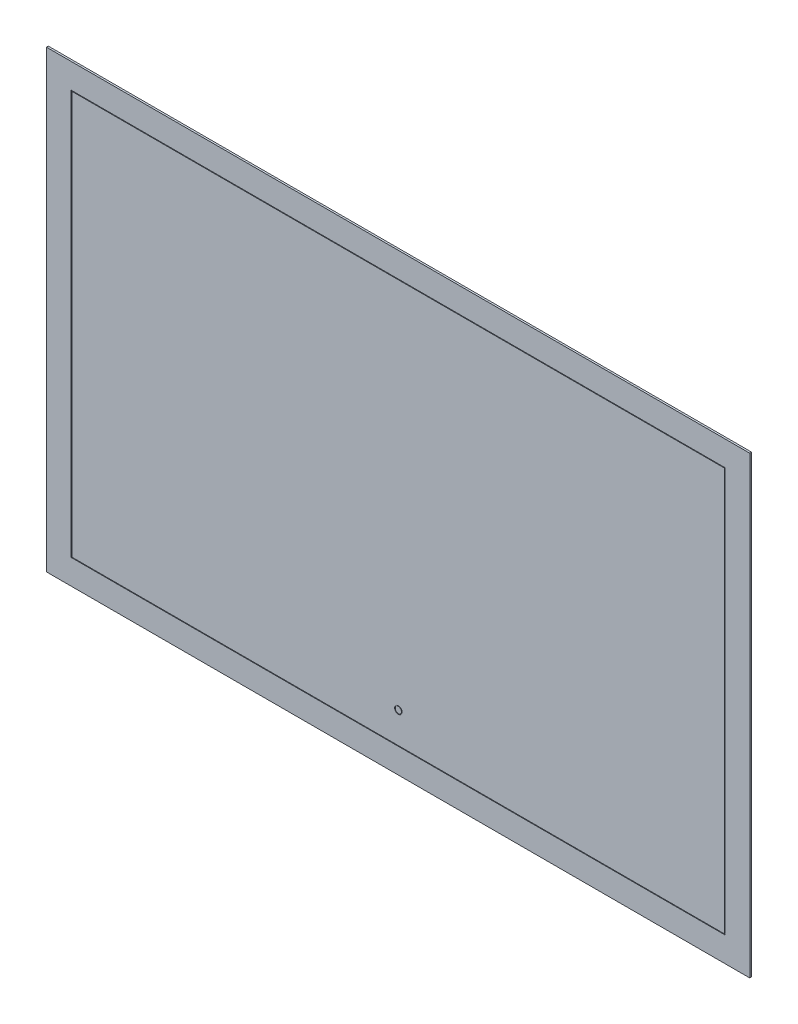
SolidWorks part; units mm, degrees
ref_plane "Alzado" through (0, 0, 0) normal (0, 0, 1) x (1, 0, 0)
ref_plane "Planta" through (0, 0, 0) normal (0, 1, 0) x (1, 0, 0)
ref_plane "Vista lateral" through (0, 0, 0) normal (1, 0, 0) x (0, 0, -1)
sketch "Croquis3" plane through (0, 0, 0) normal (0, 0, 1) x (1, 0, 0)
  line L0 (0, 0) -> (0, 730)
  line L1 (0, 730) -> (1130, 730)
  line L2 (1130, 730) -> (1130, 0)
  line L3 (1130, 0) -> (0, 0)
  line L4 (40, 690) -> (1090, 690)
  line L5 (1090, 690) -> (1090, 40)
  line L6 (1090, 40) -> (40, 40)
  line L7 (40, 40) -> (40, 690)
  line L8 (41, 41) -> (41, 689)
  line L9 (41, 689) -> (1089, 689)
  line L10 (1089, 689) -> (1089, 41)
  line L11 (1089, 41) -> (41, 41)
  dimension "D1" = 730
  dimension "D2" = 1130
  dimension "D3" = 40
  dimension "D4" = 1
extrude "Saliente-Extruir1" add sketch "Croquis3" along normal blind 3 contours L3 L2 L1 L0 L6 L7 L4 L5 | L7 L6 L5 L4 L10 L11 L8 L9 | L11 L10 L9 L8
sketch "Croquis5" plane through (0, 0, 3) normal (0, 0, 1) x (1, 0, 0)
  line L4 (41, 689) -> (41, 41)
  line L5 (41, 41) -> (1089, 41)
  line L6 (1089, 41) -> (1089, 689)
  line L7 (1089, 689) -> (41, 689)
  line L8 (40, 40) -> (1090, 40)
  line L9 (1090, 40) -> (1090, 690)
  line L10 (1090, 690) -> (40, 690)
  line L11 (40, 690) -> (40, 40)
  line L12 (40, 40) -> (1090, 40)
  line L13 (1090, 40) -> (1090, 690)
  line L14 (1090, 690) -> (40, 690)
  line L15 (40, 690) -> (40, 40)
  dimension "D1" = 40
  dimension "D2" = 1
extrude "Cortar-Extruir1" cut sketch "Croquis5" against normal blind 1
sketch "Croquis6" plane through (0, 0, 0) normal (0, 0, -1) x (-1, 0, 0)
  line L8 (-1095, 35) -> (-35, 35)
  line L9 (-35, 35) -> (-35, 695)
  line L10 (-35, 695) -> (-1095, 695)
  line L11 (-1095, 695) -> (-1095, 35)
  line L12 (-1095, 35) -> (-35, 35)
  line L13 (-35, 35) -> (-35, 695)
  line L14 (-35, 695) -> (-1095, 695)
  line L15 (-1095, 695) -> (-1095, 35)
  dimension "D1" = 35
extrude "Saliente-Extruir2" add sketch "Croquis6" along normal blind 30
sketch "Croquis7" plane through (0, 0, -30) normal (0, 0, -1) x (-1, 0, 0)
  line L12 (-1094, 694) -> (-1094, 36)
  line L13 (-1094, 36) -> (-36, 36)
  line L14 (-36, 36) -> (-36, 694)
  line L15 (-36, 694) -> (-1094, 694)
  line L16 (-1094, 694) -> (-1094, 36)
  line L17 (-1094, 36) -> (-36, 36)
  line L18 (-36, 36) -> (-36, 694)
  line L19 (-36, 694) -> (-1094, 694)
  dimension "D1" = 1
extrude "Cortar-Extruir2" cut sketch "Croquis7" against normal blind 30
sketch "Croquis8" plane through (0, 0, 3) normal (0, 0, 1) x (1, 0, 0)
  line L0 (1090, 690) -> (41, 41) construction
  line L1 (40, 690) -> (1090, 40) construction
  line L2 (565.5, 365.5) -> (565.5, 90.5) construction
  circle A0 centre (565.5, 90.5) radius 5
  circle A1 centre (565.5, 90.5) radius 6
extrude "Cortar-Extruir3" cut sketch "Croquis8" against normal blind 1
